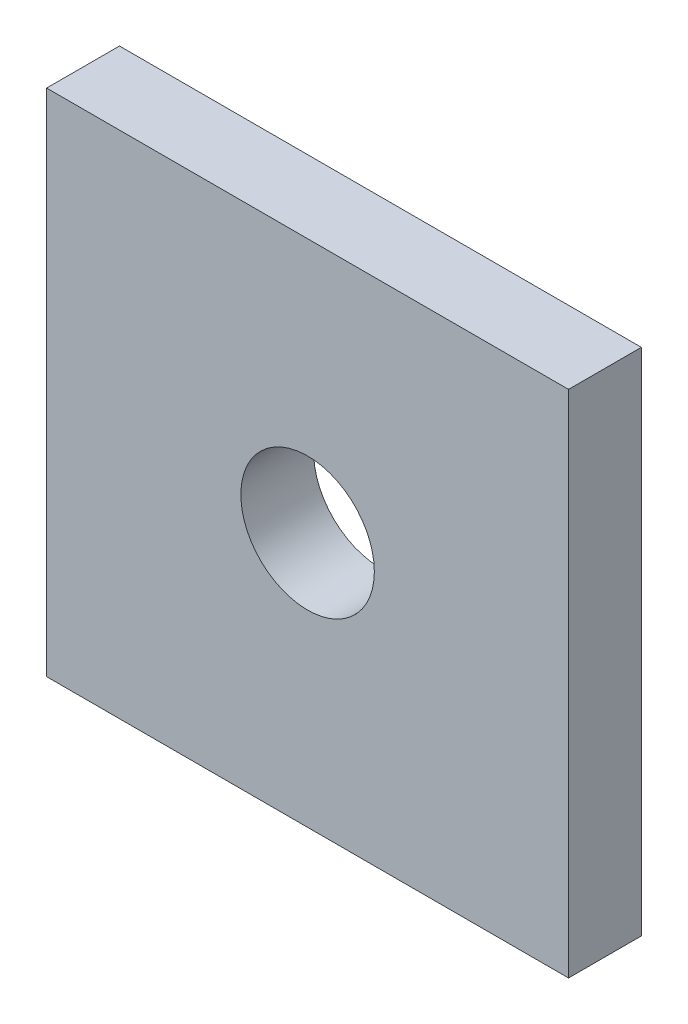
SolidWorks part; units mm, degrees
ref_plane "Front Plane" through (0, 0, 0) normal (0, 0, 1) x (1, 0, 0)
ref_plane "Top Plane" through (0, 0, 0) normal (0, 1, 0) x (1, 0, 0)
ref_plane "Right Plane" through (0, 0, 0) normal (1, 0, 0) x (0, 0, -1)
sketch "Sketch1" plane through (0, 0, 0) normal (0, 0, 1) x (1, 0, 0)
  line L1 (-21.5, 21) -> (21.5, 21)
  line L2 (-21.5, 21) -> (-21.5, -21)
  line L3 (-21.5, -21) -> (21.5, -21)
  line L4 (21.5, 21) -> (21.5, -21)
  line L5 (-21.5, 21) -> (21.5, -21) construction
  line L6 (-21.5, -21) -> (21.5, 21) construction
  circle A0 centre (0, 0) radius 5.5
  point P0 (0, 0)
  dimension "D3" = 11
  dimension "D1" = 43
  dimension "D2" = 42
extrude "Boss-Extrude1" add sketch "Sketch1" along normal blind 6
